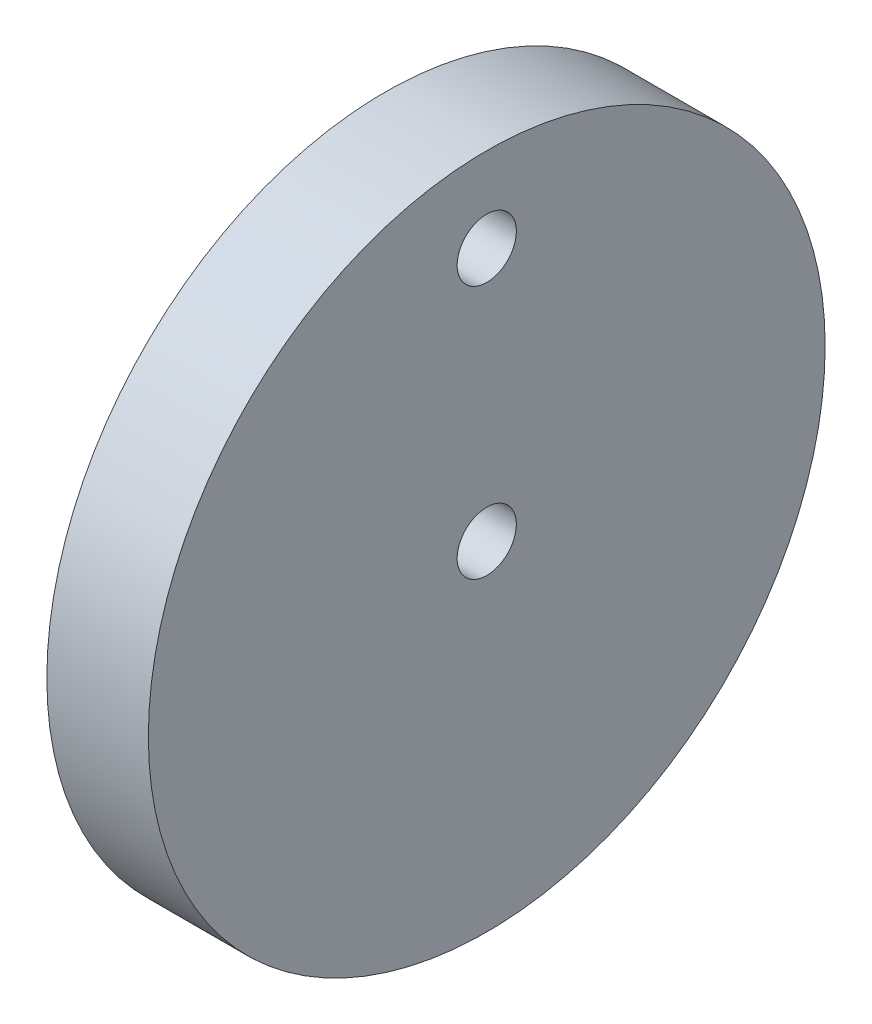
SolidWorks part; units mm, degrees
ref_plane "Front Plane" through (0, 0, 0) normal (0, 0, 1) x (1, 0, 0)
ref_plane "Top Plane" through (0, 0, 0) normal (0, 1, 0) x (1, 0, 0)
ref_plane "Right Plane" through (0, 0, 0) normal (1, 0, 0) x (0, 0, -1)
sketch "Sketch1" plane through (0, 0, 0) normal (1, 0, 0) x (0, 0, -1)
  line L0 (0, 0) -> (0, 20) construction
  circle A0 centre (0, 0) radius 20
  circle A1 centre (0, 0) radius 1.75
  circle A2 centre (0, 15) radius 1.75
  dimension "D1" = 40
  dimension "D2" = 3.5
  dimension "D3" = 3.5
  dimension "D4" = 15
extrude "Extrude1" add sketch "Sketch1" along normal blind 6
